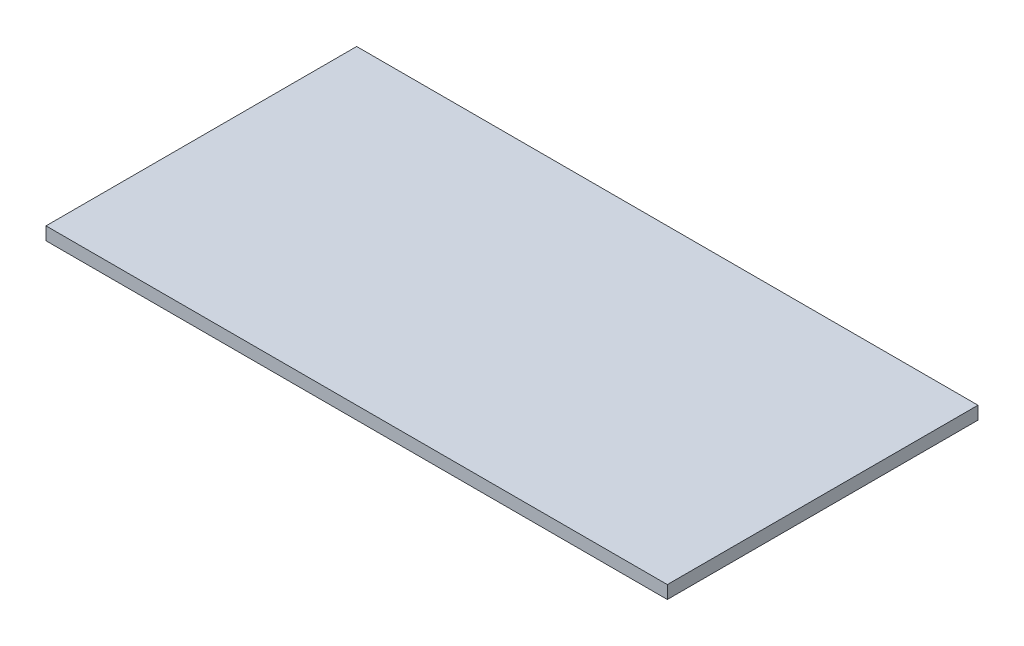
SolidWorks part; units mm, degrees
ref_plane "Ebene vorne" through (0, 0, 0) normal (0, 0, 1) x (1, 0, 0)
ref_plane "Ebene oben" through (0, 0, 0) normal (0, 1, 0) x (1, 0, 0)
ref_plane "Ebene rechts" through (0, 0, 0) normal (1, 0, 0) x (0, 0, -1)
sketch "Skizze1" plane through (0, 0, 0) normal (0, 1, 0) x (1, 0, 0)
  line L0 (-522.5, 700) -> (522.5, 700) construction
  line L2 (-1200, 700) -> (1200, 700)
  line L3 (-1200, 700) -> (-1200, -500)
  line L4 (-1200, -500) -> (1200, -500)
  line L5 (1200, 700) -> (1200, -500)
  line L7 (-522.5, -500) -> (522.5, -500) construction
  line L10 (-1200, -297) -> (-1200, 297) construction
  line L11 (1200, -297) -> (1200, 297) construction
extrude "Aufsatz-Linear austragen1" add sketch "Skizze1" along normal blind 50
